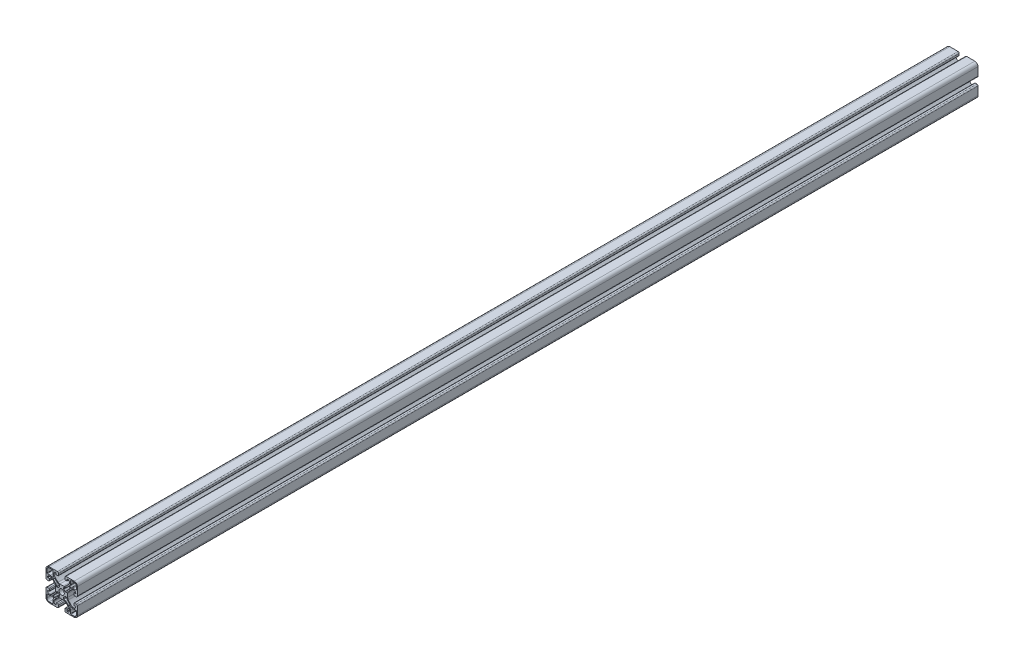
SolidWorks part; units mm, degrees
ref_plane "Face" through (0, 0, 0) normal (0, 0, 1) x (1, 0, 0)
ref_plane "Dessus" through (0, 0, 0) normal (0, 1, 0) x (1, 0, 0)
ref_plane "Droite" through (0, 0, 0) normal (1, 0, 0) x (0, 0, -1)
sketch "Esquisse profilé" plane through (0, 0, 0) normal (0, 0, 1) x (1, 0, 0)
  line L0 (11.6997, 18.8) -> (16, 18.8)
  line L1 (18.8, 16) -> (18.8, 11.7)
  line L2 (18.3, 11.2) -> (14.67, 11.2)
  line L3 (12.3957, 10.2874) -> (12.7389, 10.5517)
  line L4 (11.7339, 10.3275) -> (10.3272, 11.7342)
  line L5 (10.5513, 12.7393) -> (10.2871, 12.3961)
  line L6 (11.1997, 14.6704) -> (11.1997, 18.3)
  line L7 (-11.1997, 14.6699) -> (-11.1997, 18.3)
  line L8 (-10.5517, 12.7393) -> (-10.2874, 12.3961)
  line L9 (-11.7342, 10.3275) -> (-10.3275, 11.7342)
  line L10 (-12.3961, 10.2874) -> (-12.7393, 10.5517)
  line L11 (-18.3, 11.2) -> (-14.6704, 11.2)
  line L12 (-18.8, 16) -> (-18.8, 11.7)
  line L13 (-11.6997, 18.8) -> (-16, 18.8)
  line L14 (-2.5, 6.0982) -> (-2.5, 4.6098)
  line L15 (-4.6098, 2.5) -> (-6.0982, 2.5)
  line L16 (-10.7615, 9.6032) -> (-9.6032, 10.7615)
  line L17 (-10.7615, -9.6032) -> (-9.6032, -10.7615)
  line L18 (-4.6098, -2.5) -> (-6.0982, -2.5)
  line L19 (-2.5, -6.0982) -> (-2.5, -4.6098)
  line L20 (-11.7, -18.8) -> (-16, -18.8)
  line L21 (-18.8, -16) -> (-18.8, -11.7)
  line L22 (-18.3, -11.2) -> (-14.6704, -11.2)
  line L23 (-12.3961, -10.2874) -> (-12.7393, -10.5517)
  line L24 (-11.7342, -10.3275) -> (-10.3275, -11.7342)
  line L25 (-10.5517, -12.7393) -> (-10.2874, -12.3961)
  line L26 (-11.2, -14.6704) -> (-11.2, -18.3)
  line L27 (9.6032, 10.7615) -> (10.7615, 9.6032)
  line L28 (6.0982, 2.5) -> (4.6098, 2.5)
  line L29 (2.5, 4.6098) -> (2.5, 6.0982)
  line L30 (2.5, -4.6098) -> (2.5, -6.0982)
  line L31 (6.0982, -2.5) -> (4.6098, -2.5)
  line L32 (9.6032, -10.7615) -> (10.7615, -9.6032)
  line L33 (11.1997, -14.6704) -> (11.1997, -18.3)
  line L34 (10.5513, -12.7393) -> (10.2871, -12.3961)
  line L35 (11.7339, -10.3275) -> (10.3272, -11.7342)
  line L36 (12.3957, -10.2874) -> (12.7389, -10.5517)
  line L37 (18.3, -11.2) -> (14.67, -11.2)
  line L38 (18.8, -16) -> (18.8, -11.7)
  line L39 (11.6997, -18.8) -> (16, -18.8)
  line L40 (5.5, -20) -> (16, -20)
  line L41 (4, -16.5) -> (4, -18.5)
  line L42 (6.75, -15.5) -> (5, -15.5)
  line L43 (7, -17.75) -> (7, -15.75)
  line L44 (7.5, -18) -> (7.25, -18)
  line L45 (10, -14.7204) -> (10, -15.5)
  line L46 (-2.1931, -7.75) -> (2.1931, -7.75)
  line L47 (-10, -15.5) -> (-10, -14.7204)
  line L48 (-7.25, -18) -> (-7.5, -18)
  line L49 (-7, -15.75) -> (-7, -17.75)
  line L50 (-5, -15.5) -> (-6.75, -15.5)
  line L51 (-4, -18.5) -> (-4, -16.5)
  line L52 (-16, -20) -> (-5.5, -20)
  line L53 (-20, -5.5) -> (-20, -16)
  line L54 (-16.5, -4) -> (-18.5, -4)
  line L55 (-15.5, -6.75) -> (-15.5, -5)
  line L56 (-17.75, -7) -> (-15.75, -7)
  line L57 (-18, -7.5) -> (-18, -7.25)
  line L58 (-14.7204, -10) -> (-15.5, -10)
  line L59 (-7.75, 2.1931) -> (-7.75, -2.1931)
  line L60 (-15.5, 10) -> (-14.7204, 10)
  line L61 (-18, 7.25) -> (-18, 7.5)
  line L62 (-15.75, 7) -> (-17.75, 7)
  line L63 (-15.5, 5) -> (-15.5, 6.75)
  line L64 (-18.5, 4) -> (-16.5, 4)
  line L65 (-20, 16) -> (-20, 5.5)
  line L66 (-5.5, 20) -> (-16, 20)
  line L67 (-4, 16.5) -> (-4, 18.5)
  line L68 (-6.75, 15.5) -> (-5, 15.5)
  line L69 (-7, 17.75) -> (-7, 15.75)
  line L70 (-7.5, 18) -> (-7.25, 18)
  line L71 (-10, 14.7204) -> (-10, 15.5)
  line L72 (2.1931, 7.75) -> (-2.1931, 7.75)
  line L73 (10, 15.5) -> (10, 14.7204)
  line L74 (7.25, 18) -> (7.5, 18)
  line L75 (7, 15.75) -> (7, 17.75)
  line L76 (5, 15.5) -> (6.75, 15.5)
  line L77 (4, 18.5) -> (4, 16.5)
  line L78 (16, 20) -> (5.5, 20)
  line L79 (20, 5.5) -> (20, 16)
  line L80 (16.5, 4) -> (18.5, 4)
  line L81 (15.5, 6.75) -> (15.5, 5)
  line L82 (17.75, 7) -> (15.75, 7)
  line L83 (18, 7.5) -> (18, 7.25)
  line L84 (14.7204, 10) -> (15.5, 10)
  line L85 (7.75, -2.1931) -> (7.75, 2.1931)
  line L86 (15.5, -10) -> (14.7204, -10)
  line L87 (18, -7.25) -> (18, -7.5)
  line L88 (15.75, -7) -> (17.75, -7)
  line L89 (15.5, -5) -> (15.5, -6.75)
  line L90 (18.5, -4) -> (16.5, -4)
  line L91 (20, -16) -> (20, -5.5)
  arc A0 (11.1997, 18.3) -> (11.6997, 18.8) centre (11.6997, 18.3) cw
  arc A1 (-11.1997, 14.6699) -> (-10.5517, 12.7393) centre (-7.9997, 14.6699) ccw
  arc A2 (16, 18.8) -> (18.8, 16) centre (16, 16) cw
  arc A3 (18.8, 11.7) -> (18.3, 11.2) centre (18.3, 11.7) cw
  arc A4 (12.7389, 10.5517) -> (14.67, 11.2) centre (14.67, 8) cw
  arc A5 (12.3957, 10.2874) -> (11.7339, 10.3275) centre (12.0874, 10.6811) cw
  arc A6 (10.3272, 11.7342) -> (10.2871, 12.3961) centre (10.6807, 12.0878) cw
  arc A7 (11.1997, 14.6704) -> (10.5513, 12.7393) centre (7.9997, 14.6704) cw
  arc A8 (-10.3275, 11.7342) -> (-10.2874, 12.3961) centre (-10.6811, 12.0878) ccw
  arc A9 (-12.3961, 10.2874) -> (-11.7342, 10.3275) centre (-12.0878, 10.6811) ccw
  arc A10 (-12.7393, 10.5517) -> (-14.6704, 11.2) centre (-14.6704, 8) ccw
  arc A11 (-18.8, 11.7) -> (-18.3, 11.2) centre (-18.3, 11.7) ccw
  arc A12 (-16, 18.8) -> (-18.8, 16) centre (-16, 16) ccw
  arc A13 (-11.1997, 18.3) -> (-11.6997, 18.8) centre (-11.6997, 18.3) ccw
  arc A14 (-8.8828, 10.7477) -> (-5.38, 7.59) centre (10.34, 28.55) ccw
  arc A15 (-5.38, 7.59) -> (-2.9351, 6.594) centre (-2.26, 11.75) ccw
  arc A16 (-2.5, 6.0982) -> (-2.9351, 6.594) centre (-3, 6.0982) ccw
  arc A17 (-2.7273, 4.1907) -> (-2.5, 4.6098) centre (-3, 4.6098) ccw
  arc A18 (-2.7273, 4.1907) -> (-4.1907, 2.7273) centre (0, 0) ccw
  arc A19 (-4.6098, 2.5) -> (-4.1907, 2.7273) centre (-4.6098, 3) ccw
  arc A20 (-6.594, 2.9351) -> (-6.0982, 2.5) centre (-6.0982, 3) ccw
  arc A21 (-6.594, 2.9351) -> (-7.59, 5.38) centre (-11.75, 2.26) ccw
  arc A22 (-7.59, 5.38) -> (-10.7477, 8.8828) centre (-28.55, -10.34) ccw
  arc A23 (-10.7615, 9.6032) -> (-10.7477, 8.8828) centre (-10.4079, 9.2497) ccw
  arc A24 (-8.8828, 10.7477) -> (-9.6032, 10.7615) centre (-9.2497, 10.4079) ccw
  arc A25 (-8.8828, -10.7477) -> (-9.6032, -10.7615) centre (-9.2497, -10.4079) cw
  arc A26 (-10.7615, -9.6032) -> (-10.7477, -8.8828) centre (-10.4079, -9.2497) cw
  arc A27 (-7.59, -5.38) -> (-10.7477, -8.8828) centre (-28.55, 10.34) cw
  arc A28 (-6.594, -2.9351) -> (-7.59, -5.38) centre (-11.75, -2.26) cw
  arc A29 (-6.594, -2.9351) -> (-6.0982, -2.5) centre (-6.0982, -3) cw
  arc A30 (-4.6098, -2.5) -> (-4.1907, -2.7273) centre (-4.6098, -3) cw
  arc A31 (-2.7273, -4.1907) -> (-4.1907, -2.7273) centre (0, 0) cw
  arc A32 (-2.7273, -4.1907) -> (-2.5, -4.6098) centre (-3, -4.6098) cw
  arc A33 (-2.5, -6.0982) -> (-2.9351, -6.594) centre (-3, -6.0982) cw
  arc A34 (-5.38, -7.59) -> (-2.9351, -6.594) centre (-2.26, -11.75) cw
  arc A35 (-8.8828, -10.7477) -> (-5.38, -7.59) centre (10.34, -28.55) cw
  arc A36 (-11.2, -18.3) -> (-11.7, -18.8) centre (-11.7, -18.3) cw
  arc A37 (-16, -18.8) -> (-18.8, -16) centre (-16, -16) cw
  arc A38 (-18.8, -11.7) -> (-18.3, -11.2) centre (-18.3, -11.7) cw
  arc A39 (-12.7393, -10.5517) -> (-14.6704, -11.2) centre (-14.6704, -8) cw
  arc A40 (-12.3961, -10.2874) -> (-11.7342, -10.3275) centre (-12.0878, -10.6811) cw
  arc A41 (-10.3275, -11.7342) -> (-10.2874, -12.3961) centre (-10.6811, -12.0878) cw
  arc A42 (-11.2, -14.6704) -> (-10.5517, -12.7393) centre (-8, -14.6704) cw
  arc A43 (10.7477, 8.8828) -> (10.7615, 9.6032) centre (10.4079, 9.2497) ccw
  arc A44 (10.7477, 8.8828) -> (7.59, 5.38) centre (28.55, -10.34) ccw
  arc A45 (7.59, 5.38) -> (6.594, 2.9351) centre (11.75, 2.26) ccw
  arc A46 (6.0982, 2.5) -> (6.594, 2.9351) centre (6.0982, 3) ccw
  arc A47 (4.1907, 2.7273) -> (4.6098, 2.5) centre (4.6098, 3) ccw
  arc A48 (4.1907, 2.7273) -> (2.7273, 4.1907) centre (0, 0) ccw
  arc A49 (2.5, 4.6098) -> (2.7273, 4.1907) centre (3, 4.6098) ccw
  arc A50 (2.9351, 6.594) -> (2.5, 6.0982) centre (3, 6.0982) ccw
  arc A51 (2.9351, 6.594) -> (5.38, 7.59) centre (2.26, 11.75) ccw
  arc A52 (5.38, 7.59) -> (8.8828, 10.7477) centre (-10.34, 28.55) ccw
  arc A53 (9.6032, 10.7615) -> (8.8828, 10.7477) centre (9.2497, 10.4079) ccw
  arc A54 (9.6032, -10.7615) -> (8.8828, -10.7477) centre (9.2497, -10.4079) cw
  arc A55 (5.38, -7.59) -> (8.8828, -10.7477) centre (-10.34, -28.55) cw
  arc A56 (2.9351, -6.594) -> (5.38, -7.59) centre (2.26, -11.75) cw
  arc A57 (2.9351, -6.594) -> (2.5, -6.0982) centre (3, -6.0982) cw
  arc A58 (2.5, -4.6098) -> (2.7273, -4.1907) centre (3, -4.6098) cw
  arc A59 (4.1907, -2.7273) -> (2.7273, -4.1907) centre (0, 0) cw
  arc A60 (4.1907, -2.7273) -> (4.6098, -2.5) centre (4.6098, -3) cw
  arc A61 (6.0982, -2.5) -> (6.594, -2.9351) centre (6.0982, -3) cw
  arc A62 (7.59, -5.38) -> (6.594, -2.9351) centre (11.75, -2.26) cw
  arc A63 (10.7477, -8.8828) -> (7.59, -5.38) centre (28.55, 10.34) cw
  arc A64 (10.7477, -8.8828) -> (10.7615, -9.6032) centre (10.4079, -9.2497) cw
  arc A65 (11.1997, -14.6704) -> (10.5513, -12.7393) centre (7.9997, -14.6704) ccw
  arc A66 (10.3272, -11.7342) -> (10.2871, -12.3961) centre (10.6807, -12.0878) ccw
  arc A67 (12.3957, -10.2874) -> (11.7339, -10.3275) centre (12.0874, -10.6811) ccw
  arc A68 (12.7389, -10.5517) -> (14.67, -11.2) centre (14.67, -8) ccw
  arc A69 (18.8, -11.7) -> (18.3, -11.2) centre (18.3, -11.7) ccw
  arc A70 (16, -18.8) -> (18.8, -16) centre (16, -16) ccw
  arc A71 (11.1997, -18.3) -> (11.6997, -18.8) centre (11.6997, -18.3) ccw
  circle A72 centre (0, 0) radius 3.4
  arc A73 (16, -20) -> (20, -16) centre (16, -16) ccw
  arc A74 (4, -18.5) -> (5.5, -20) centre (5.5, -18.5) ccw
  arc A75 (5, -15.5) -> (4, -16.5) centre (5, -16.5) ccw
  arc A76 (7, -15.75) -> (6.75, -15.5) centre (6.75, -15.75) ccw
  arc A77 (7, -17.75) -> (7.25, -18) centre (7.25, -17.75) ccw
  arc A78 (7.5, -18) -> (10, -15.5) centre (7.5, -15.5) ccw
  arc A79 (10, -14.7204) -> (9.5948, -13.5134) centre (8, -14.7204) ccw
  arc A80 (9.5948, -13.5134) -> (4.5803, -8.5405) centre (-10.34, -28.6) ccw
  arc A81 (4.5803, -8.5405) -> (2.1931, -7.75) centre (2.1931, -11.75) ccw
  arc A82 (-2.1931, -7.75) -> (-4.5803, -8.5405) centre (-2.1931, -11.75) ccw
  arc A83 (-4.5803, -8.5405) -> (-9.5948, -13.5134) centre (10.34, -28.6) ccw
  arc A84 (-9.5948, -13.5134) -> (-10, -14.7204) centre (-8, -14.7204) ccw
  arc A85 (-10, -15.5) -> (-7.5, -18) centre (-7.5, -15.5) ccw
  arc A86 (-7.25, -18) -> (-7, -17.75) centre (-7.25, -17.75) ccw
  arc A87 (-6.75, -15.5) -> (-7, -15.75) centre (-6.75, -15.75) ccw
  arc A88 (-4, -16.5) -> (-5, -15.5) centre (-5, -16.5) ccw
  arc A89 (-5.5, -20) -> (-4, -18.5) centre (-5.5, -18.5) ccw
  arc A90 (-20, -16) -> (-16, -20) centre (-16, -16) ccw
  arc A91 (-18.5, -4) -> (-20, -5.5) centre (-18.5, -5.5) ccw
  arc A92 (-15.5, -5) -> (-16.5, -4) centre (-16.5, -5) ccw
  arc A93 (-15.75, -7) -> (-15.5, -6.75) centre (-15.75, -6.75) ccw
  arc A94 (-17.75, -7) -> (-18, -7.25) centre (-17.75, -7.25) ccw
  arc A95 (-18, -7.5) -> (-15.5, -10) centre (-15.5, -7.5) ccw
  arc A96 (-14.7204, -10) -> (-13.5134, -9.5948) centre (-14.7204, -8) ccw
  arc A97 (-13.5134, -9.5948) -> (-8.5405, -4.5803) centre (-28.6, 10.34) ccw
  arc A98 (-8.5405, -4.5803) -> (-7.75, -2.1931) centre (-11.75, -2.1931) ccw
  arc A99 (-7.75, 2.1931) -> (-8.5405, 4.5803) centre (-11.75, 2.1931) ccw
  arc A100 (-8.5405, 4.5803) -> (-13.5134, 9.5948) centre (-28.6, -10.34) ccw
  arc A101 (-13.5134, 9.5948) -> (-14.7204, 10) centre (-14.7204, 8) ccw
  arc A102 (-15.5, 10) -> (-18, 7.5) centre (-15.5, 7.5) ccw
  arc A103 (-18, 7.25) -> (-17.75, 7) centre (-17.75, 7.25) ccw
  arc A104 (-15.5, 6.75) -> (-15.75, 7) centre (-15.75, 6.75) ccw
  arc A105 (-16.5, 4) -> (-15.5, 5) centre (-16.5, 5) ccw
  arc A106 (-20, 5.5) -> (-18.5, 4) centre (-18.5, 5.5) ccw
  arc A107 (-16, 20) -> (-20, 16) centre (-16, 16) ccw
  arc A108 (-4, 18.5) -> (-5.5, 20) centre (-5.5, 18.5) ccw
  arc A109 (-5, 15.5) -> (-4, 16.5) centre (-5, 16.5) ccw
  arc A110 (-7, 15.75) -> (-6.75, 15.5) centre (-6.75, 15.75) ccw
  arc A111 (-7, 17.75) -> (-7.25, 18) centre (-7.25, 17.75) ccw
  arc A112 (-7.5, 18) -> (-10, 15.5) centre (-7.5, 15.5) ccw
  arc A113 (-10, 14.7204) -> (-9.5948, 13.5134) centre (-8, 14.7204) ccw
  arc A114 (-9.5948, 13.5134) -> (-4.5803, 8.5405) centre (10.34, 28.6) ccw
  arc A115 (-4.5803, 8.5405) -> (-2.1931, 7.75) centre (-2.1931, 11.75) ccw
  arc A116 (2.1931, 7.75) -> (4.5803, 8.5405) centre (2.1931, 11.75) ccw
  arc A117 (4.5803, 8.5405) -> (9.5948, 13.5134) centre (-10.34, 28.6) ccw
  arc A118 (9.5948, 13.5134) -> (10, 14.7204) centre (8, 14.7204) ccw
  arc A119 (10, 15.5) -> (7.5, 18) centre (7.5, 15.5) ccw
  arc A120 (7.25, 18) -> (7, 17.75) centre (7.25, 17.75) ccw
  arc A121 (6.75, 15.5) -> (7, 15.75) centre (6.75, 15.75) ccw
  arc A122 (4, 16.5) -> (5, 15.5) centre (5, 16.5) ccw
  arc A123 (5.5, 20) -> (4, 18.5) centre (5.5, 18.5) ccw
  arc A124 (20, 16) -> (16, 20) centre (16, 16) ccw
  arc A125 (18.5, 4) -> (20, 5.5) centre (18.5, 5.5) ccw
  arc A126 (15.5, 5) -> (16.5, 4) centre (16.5, 5) ccw
  arc A127 (15.75, 7) -> (15.5, 6.75) centre (15.75, 6.75) ccw
  arc A128 (17.75, 7) -> (18, 7.25) centre (17.75, 7.25) ccw
  arc A129 (18, 7.5) -> (15.5, 10) centre (15.5, 7.5) ccw
  arc A130 (14.7204, 10) -> (13.5134, 9.5948) centre (14.7204, 8) ccw
  arc A131 (13.5134, 9.5948) -> (8.5405, 4.5803) centre (28.6, -10.34) ccw
  arc A132 (8.5405, 4.5803) -> (7.75, 2.1931) centre (11.75, 2.1931) ccw
  arc A133 (7.75, -2.1931) -> (8.5405, -4.5803) centre (11.75, -2.1931) ccw
  arc A134 (8.5405, -4.5803) -> (13.5134, -9.5948) centre (28.6, 10.34) ccw
  arc A135 (13.5134, -9.5948) -> (14.7204, -10) centre (14.7204, -8) ccw
  arc A136 (15.5, -10) -> (18, -7.5) centre (15.5, -7.5) ccw
  arc A137 (18, -7.25) -> (17.75, -7) centre (17.75, -7.25) ccw
  arc A138 (15.5, -6.75) -> (15.75, -7) centre (15.75, -6.75) ccw
  arc A139 (16.5, -4) -> (15.5, -5) centre (16.5, -5) ccw
  arc A140 (20, -5.5) -> (18.5, -4) centre (18.5, -5.5) ccw
extrude "Extrusion1" add sketch "Esquisse profilé" along normal blind 1150
